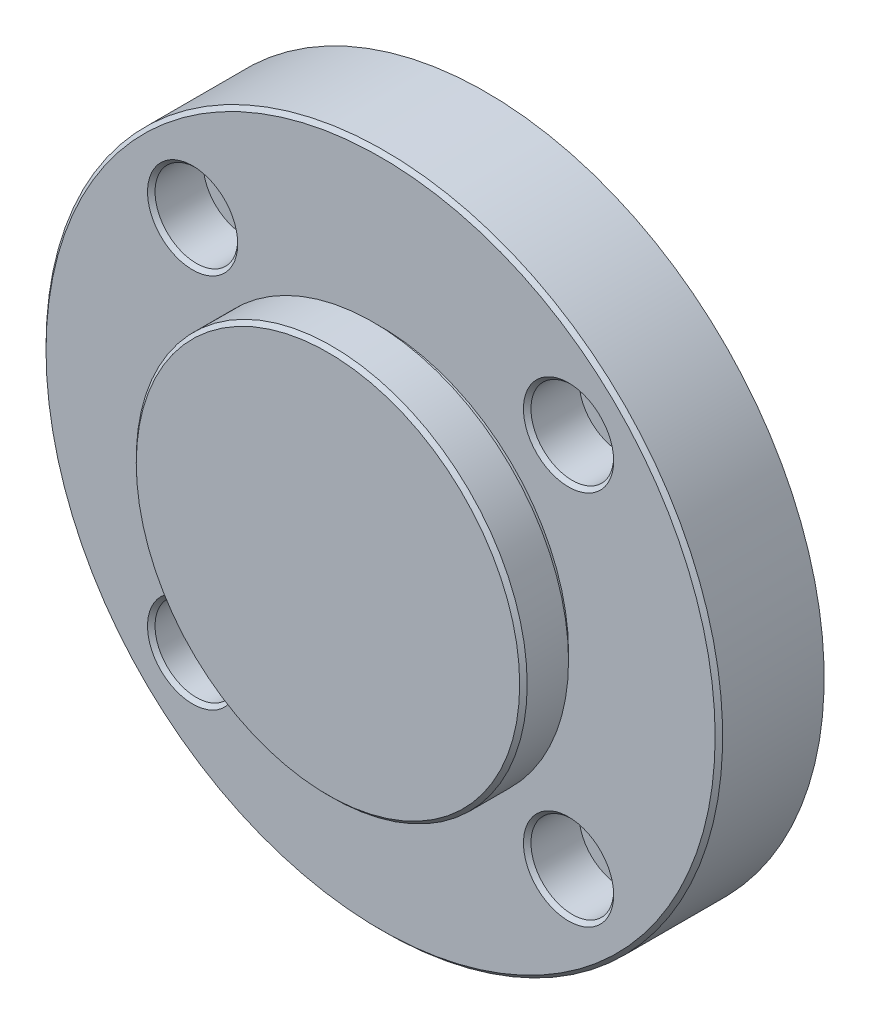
SolidWorks part; units mm, degrees
ref_plane "Plan de face" through (0, 0, 0) normal (0, 0, 1) x (1, 0, 0)
ref_plane "Plan de dessus" through (0, 0, 0) normal (0, 1, 0) x (1, 0, 0)
ref_plane "Plan de droite" through (0, 0, 0) normal (1, 0, 0) x (0, 0, -1)
sketch "Esquisse1" plane through (0, 0, 0) normal (0, 0, 1) x (1, 0, 0)
  circle A0 centre (0, 0) radius 45
extrude "Boss.-Extru.1" add sketch "Esquisse1" along normal blind 21
sketch "Esquisse2" plane through (0, 0, 21) normal (0, 0, 1) x (1, 0, 0)
  circle A0 centre (0, 0) radius 26
extrude "Enlèv. mat.-Extru.1" cut sketch "Esquisse2" against normal blind 7 flip side to cut
chamfer "Chanfrein1" distance 0.5 angle 45 1 edges at (45, 0, 14)
chamfer "Chanfrein2" distance 0.5 angle 45 1 edges at (26, 0, 21)
sketch "Esquisse3" plane through (0, 0, 14) normal (0, 0, 1) x (1, 0, 0)
  circle A0 centre (0, 0) radius 25
extrude "Enlèv. mat.-Extru.2" cut sketch "Esquisse3" along normal blind 1 flip side to cut
sketch "Esquisse4" plane through (0, 0, 14) normal (0, 0, 1) x (1, 0, 0)
  line L0 (-25, 25) -> (25, 25) construction
  line L1 (-25, -25) -> (25, -25) construction
  line L2 (-25, 25) -> (-25, -25) construction
  line L3 (25, 25) -> (25, -25) construction
  dimension "D1" = 25
  dimension "D2" = 25
  dimension "D3" = 50
  dimension "D4" = 50
hole_wizard "Chambrage pour vis à tête hexagonale M61" positions "Esquisse6" profile "Esquisse5" counterbore size "M6" standard "ISO"
sketch "Esquisse6" plane through (0, 0, 14) normal (0, 0, 1) x (1, 0, 0)
  point P0 (-25, 25)
  point P1 (25, 25)
  point P4 (25, -25)
  point P7 (-25, -25)
sketch "Esquisse5" plane through (-25, 25, 14) normal (1, 0, 0) x (0, -1, 0)
  line L0 (0, 0) -> (0, 14)
  line L1 (0, 14) -> (3.3, 14)
  line L3 (3.3, 14) -> (3.3, 6.9)
  line L4 (5.5, 6.9) -> (3.3, 6.9)
  line L5 (5.5, 6.9) -> (5.5, 0.5)
  line L6 (5.5, 0.5) -> (6, 0)
  line L7 (6, 0) -> (0, 0)
  line L8 (-5.5, 0.5) -> (-6, 0) construction
  line L11 (0, -6.35) -> (0, 107.95) construction
  dimension "Diamètre du perçage jusqu'au prochain" = 6.6
  dimension "Profondeur du perçage jusqu'au prochain" = 14
  dimension "Diamètre du chambrage" = 11
  dimension "Profondeur du chambrage" = 6.9
  dimension "Diamètre du fraisage entrant" = 12
  dimension "Angle du fraisage entrant" = 90
